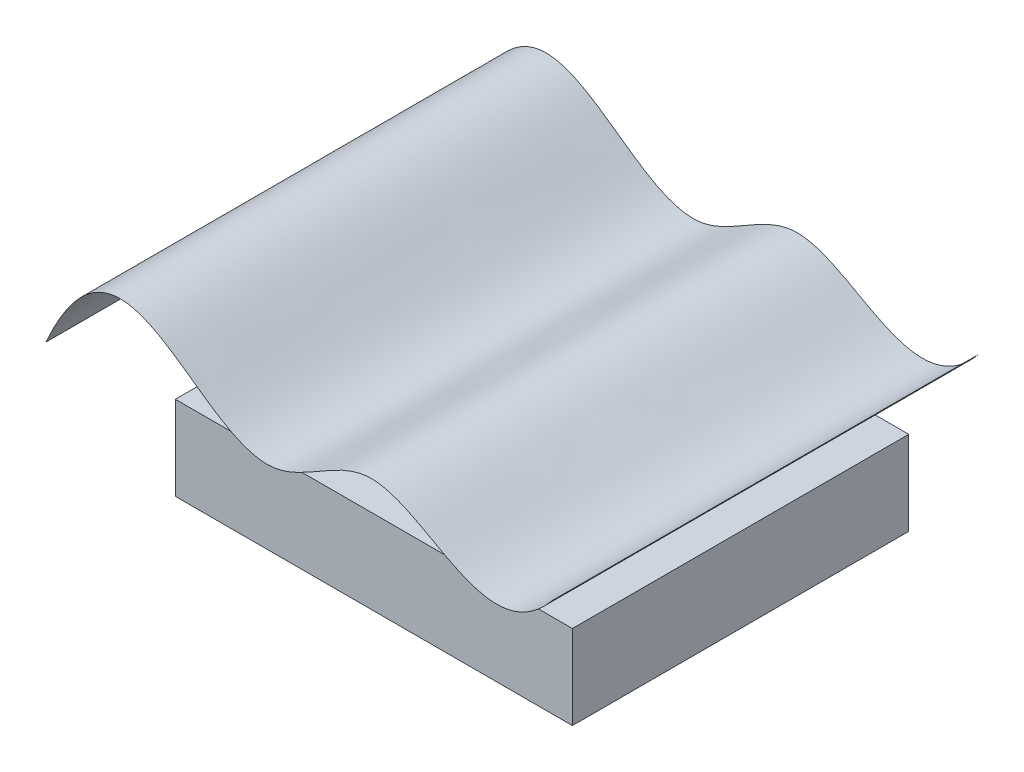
SolidWorks part; units mm, degrees
ref_plane "Front Plane" through (0, 0, 0) normal (0, 0, 1) x (1, 0, 0)
ref_plane "Top Plane" through (0, 0, 0) normal (0, 1, 0) x (1, 0, 0)
ref_plane "Right Plane" through (0, 0, 0) normal (1, 0, 0) x (0, 0, -1)
sketch "Sketch1" plane through (0, 0, 0) normal (0, 1, 0) x (1, 0, 0)
  line L1 (-94.7449, -80.2493) -> (94.7449, -80.2493)
  line L2 (-94.7449, -80.2493) -> (-94.7449, 80.2493)
  line L3 (-94.7449, 80.2493) -> (94.7449, 80.2493)
  line L4 (94.7449, -80.2493) -> (94.7449, 80.2493)
  line L5 (-94.7449, -80.2493) -> (94.7449, 80.2493) construction
  line L6 (-94.7449, 80.2493) -> (94.7449, -80.2493) construction
  point P0 (0, 0)
extrude "Boss-Extrude1" add sketch "Sketch1" along normal blind 40.132
sketch "Sketch2" plane through (0, 0, 0) normal (0, 0, 1) x (1, 0, 0)
  spline S0 degree 3 poles (-135.1078, 54.2524) (-99.3907, 135.3658) (-49.7777, 19.4804) (31.2479, 103.2732) (74.6916, 30.0451) (106.4486, 68.1726) knots 0 0 0 0 0.466698 0.647731 1 1 1 1
surface "Surface-Extrude1" sketch "Sketch2" parameters "D1"=203.2
